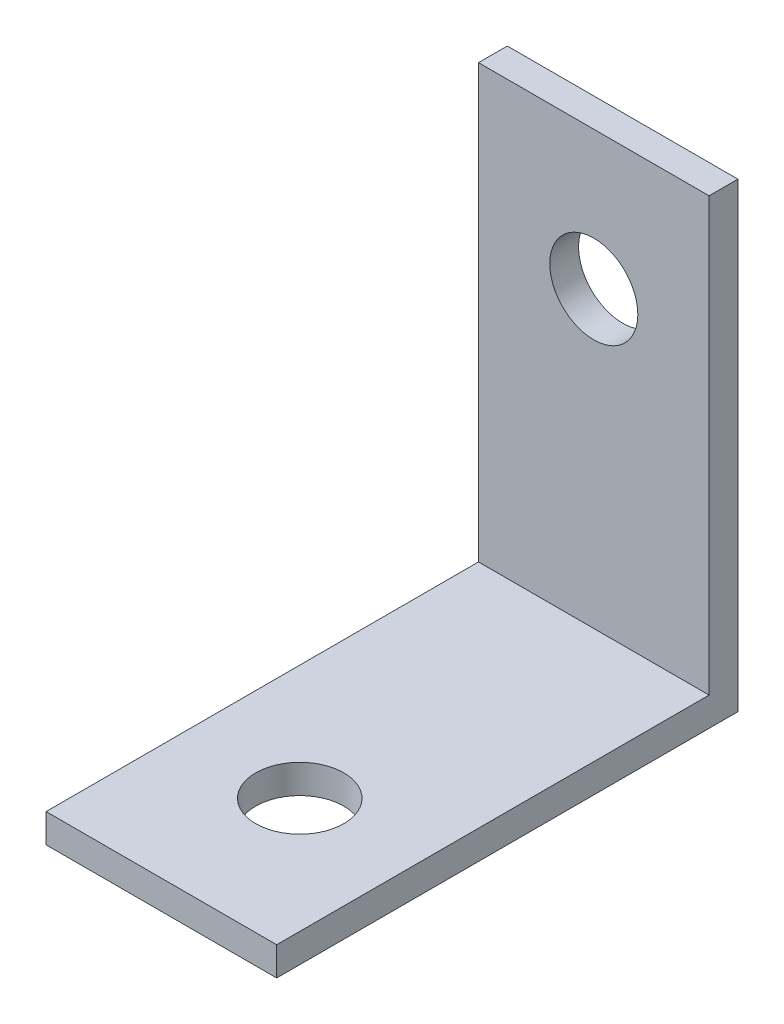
SolidWorks part; units mm, degrees
ref_plane "Front Plane" through (0, 0, 0) normal (1, 0, 0) x (0, 1, 0)
ref_plane "Top Plane" through (0, 0, 0) normal (0, 0, 1) x (0, 1, 0)
ref_plane "Right Plane" through (0, 0, 0) normal (0, 1, 0) x (-1, 0, 0)
sketch "Sketch1" plane through (0, 0, 0) normal (1, 0, 0) x (0, 1, 0)
  line L0 (0, 0) -> (25.4, 0)
  line L1 (0, 0) -> (0, 25.4)
  line L2 (1.5875, 1.5875) -> (1.5875, 25.4)
  line L3 (1.5875, 1.5875) -> (25.4, 1.5875)
  line L4 (25.4, 0) -> (25.4, 1.5875)
  line L5 (1.5875, 25.4) -> (0, 25.4)
  dimension "D1" = 25.4
  dimension "D2" = 1.5875
extrude "Boss-Extrude1" add sketch "Sketch1" along normal mid plane 12.7
ref_plane "Plane1" through (0, 0, 0) normal (0, -0.7071, 0.7071) x (0, -0.7071, -0.7071)
sketch "Sketch2" plane through (0, 0, 1.5875) normal (0, 0, 1) x (1, 0, 0)
  line L0 (6.35, 25.4) -> (-6.35, 25.4) construction
  circle A0 centre (0, 17.78) radius 2.4257
  point P5 (0, 25.4)
  dimension "D1" = 4.8514
  dimension "D2" = 7.62
extrude "Cut-Extrude1" cut sketch "Sketch2" against normal through all both and the other way through all
mirror "Mirror1" about plane through (0, 0, 0) normal (0, -0.7071, 0.7071) of "Cut-Extrude1"
